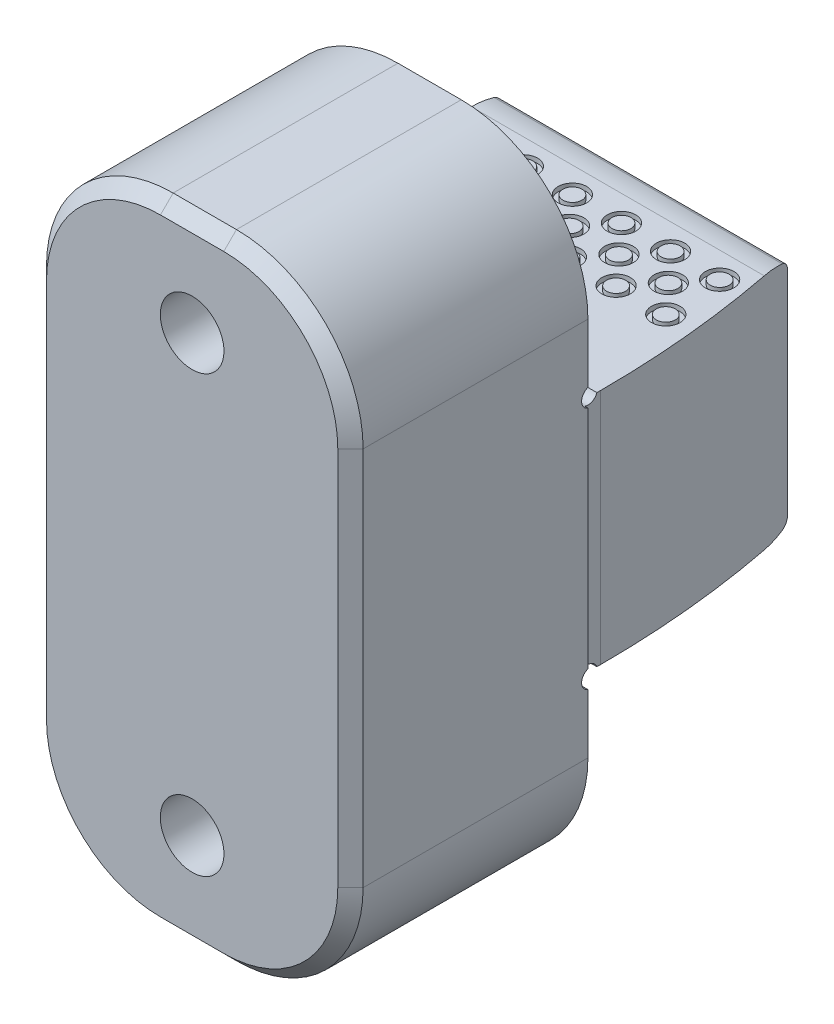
SolidWorks part; units mm, degrees
ref_plane "Front Plane" through (0, 0, 0) normal (0, 0, 1) x (1, 0, 0)
ref_plane "Top Plane" through (0, 0, 0) normal (0, 1, 0) x (1, 0, 0)
ref_plane "Right Plane" through (0, 0, 0) normal (1, 0, 0) x (0, 0, -1)
sketch "Sketch3" plane through (0, 0, 0) normal (1, 0, 0) x (0, 0, -1)
  line L0 (0, 13.97) -> (0, -13.97) construction
  line L1 (-19.05, -25.4) -> (0, -25.4)
  line L2 (-19.05, -25.4) -> (-19.05, 25.4)
  line L3 (-19.05, 25.4) -> (0, 25.4)
  line L4 (18.161, -9.5225) -> (18.161, 9.5225)
  line L6 (0, -25.4) -> (0, -9.5225)
  line L7 (0, -9.5225) -> (18.161, -9.5225)
  line L8 (0, 25.4) -> (0, 9.5225)
  line L9 (0, 9.5225) -> (18.161, 9.5225)
  line L10 (0, 0) -> (50000, 0) construction
  dimension "D1" = 37.211
  dimension "D2" = 19.05
  dimension "D3" = 50.8
  dimension "D4" = 19.0449
extrude "Extrude1" add sketch "Sketch3" along normal mid plane 25.4
sketch "Sketch7" plane through (12.7, 0, 0) normal (1, 0, 0) x (0, 0, -1)
  line L1 (0, -14.5526) -> (21.9683, -14.5526)
  line L2 (0, -14.5526) -> (0, 17.1683)
  line L3 (0, 17.1683) -> (21.9683, 17.1683)
  line L4 (21.9683, -14.5526) -> (21.9683, 17.1683)
  line L5 (0, -25.4) -> (0, -9.5225) construction
extrude "Cut-Extrude3" cut sketch "Sketch7" against normal blind 0.254
mirror "Mirror2" about plane through (0, 0, 0) normal (1, 0, 0) of "Cut-Extrude3"
sketch "Sketch8" plane through (12.7, 0, 0) normal (1, 0, 0) x (0, 0, -1)
  line L0 (0, 0) -> (50000, 0) construction
  line L1 (0, -25.4) -> (0, 25.4) construction
  line L2 (0, 9.5225) -> (18.161, 9.5225) construction
  circle A0 centre (0.254, 9.7765) radius 0.762
  circle A1 centre (0.254, -9.7765) radius 0.762
  dimension "D1" = 0.762
  dimension "D2" = 0.508
  dimension "D3" = 0.508
extrude "Cut-Extrude4" cut sketch "Sketch8" against normal through all
sketch "Sketch9" plane through (12.7, 0, 0) normal (1, 0, 0) x (0, 0, -1)
  line L0 (0.9724, 9.5225) -> (18.161, 9.5225) construction
  line L1 (18.161, 9.5225) -> (18.161, -9.5225) construction
  line L2 (0, 0) -> (50000, 0) construction
  line L3 (18.161, 8.5264) -> (22.1488, 8.5264)
  line L4 (15.7988, 9.5225) -> (15.7988, 14.8764)
  line L5 (15.7988, 14.8764) -> (22.1488, 14.8764)
  line L6 (22.1488, 8.5264) -> (22.1488, 14.8764)
  line L7 (22.1488, -8.5264) -> (22.1488, -14.8764)
  line L8 (15.7988, -14.8764) -> (22.1488, -14.8764)
  line L9 (15.7988, -9.5225) -> (15.7988, -14.8764)
  line L10 (18.161, -8.5264) -> (22.1488, -8.5264)
  arc A0 (15.7988, 9.5225) -> (17.6172, 9.2565) centre (15.7988, 3.1725) cw
  arc A1 (17.6172, 9.2565) -> (18.161, 8.5264) centre (17.399, 8.5264) cw
  arc A2 (17.6172, -9.2565) -> (18.161, -8.5264) centre (17.399, -8.5264) ccw
  arc A3 (15.7988, -9.5225) -> (17.6172, -9.2565) centre (15.7988, -3.1725) ccw
  dimension "D1" = 0.762
  dimension "D2" = 6.35
  dimension "D3" = 2.3622
  dimension "D4" = 6.35
  dimension "D5" = 6.35
extrude "Cut-Extrude5" cut sketch "Sketch9" against normal through all
sketch "Sketch13" plane through (0, 25.4, 0) normal (0, 1, 0) x (1, 0, 0)
  line L0 (12.446, 0.9724) -> (12.446, 15.7988) construction
  line L2 (8.088, 26.67) -> (20.788, 26.67)
  line L4 (12.446, 1.27) -> (20.788, 1.27)
  line L5 (20.788, 26.67) -> (20.788, 1.27)
  arc A0 (8.088, 26.67) -> (12.446, 1.27) centre (-63.754, 1.27) cw
  dimension "D1" = 76.2
  dimension "D2" = 1.27
  dimension "D3" = 25.4
  dimension "D4" = 12.7
extrude "Cut-Extrude6" cut sketch "Sketch13" against normal through all
sketch "Sketch15" plane through (0, 9.5225, 0) normal (0, 1, 0) x (1, 0, 0)
  line L0 (12.7, -19.05) -> (-12.7, -19.05) construction
  line L1 (-12.7, 15.7988) -> (-12.7, -0.4644) construction
  line L2 (-12.7, 0) -> (-12.7, -19.05) construction
  circle A0 centre (-6.223, 13.7414) radius 1.143
  circle A1 centre (-6.223, 13.7414) radius 0.762
  circle A2 centre (-2.286, 13.7414) radius 1.143
  circle A3 centre (-2.286, 13.7414) radius 0.762
  circle A4 centre (-10.16, 13.7414) radius 1.143
  circle A5 centre (-10.16, 13.7414) radius 0.762
  circle A6 centre (1.651, 13.7414) radius 1.143
  circle A7 centre (1.651, 13.7414) radius 0.762
  circle A8 centre (5.588, 13.7414) radius 1.143
  circle A9 centre (5.588, 13.7414) radius 0.762
  circle A10 centre (9.525, 13.7414) radius 1.143
  circle A11 centre (9.525, 13.7414) radius 0.762
  circle A12 centre (-4.191, 11.4554) radius 1.143
  circle A13 centre (-4.191, 11.4554) radius 0.762
  circle A14 centre (-0.2286, 11.4554) radius 1.143
  circle A15 centre (-0.2286, 11.4554) radius 0.762
  circle A16 centre (-8.1534, 11.4554) radius 1.143
  circle A17 centre (-8.1534, 11.4554) radius 0.762
  circle A18 centre (3.7338, 11.4554) radius 1.143
  circle A19 centre (3.7338, 11.4554) radius 0.762
  circle A20 centre (7.6962, 11.4554) radius 1.143
  circle A21 centre (7.6962, 11.4554) radius 0.762
  circle A24 centre (-6.1722, 9.1694) radius 1.143
  circle A25 centre (-6.1722, 9.1694) radius 0.762
  circle A26 centre (-2.1844, 9.1694) radius 1.143
  circle A27 centre (-2.1844, 9.1694) radius 0.762
  circle A28 centre (-10.16, 9.1694) radius 1.143
  circle A29 centre (-10.16, 9.1694) radius 0.762
  circle A30 centre (1.8034, 9.1694) radius 1.143
  circle A31 centre (1.8034, 9.1694) radius 0.762
  circle A32 centre (5.7912, 9.1694) radius 1.143
  circle A33 centre (5.7912, 9.1694) radius 0.762
  circle A34 centre (9.779, 9.1694) radius 1.143
  circle A35 centre (9.779, 9.1694) radius 0.762
  dimension "D1" = 32.7914
  dimension "D2" = 2.286
  dimension "D12" = 3.9878
  dimension "D7" = 2.286
  dimension "D8" = 1.524
  dimension "D3" = 2.286
  dimension "D4" = 2.54
  dimension "D5" = 4.5466
  dimension "D6" = 3.9878
  dimension "D9" = 3.9878
  dimension "D10" = 3.9878
  dimension "D11" = 3.9878
  dimension "D13" = 3.937
  dimension "D14" = 3.937
  dimension "D15" = 3.937
  dimension "D16" = 3.937
  dimension "D17" = 3.937
  dimension "D18" = 3.9624
  dimension "D19" = 3.9624
  dimension "D20" = 3.9624
  dimension "D21" = 3.9624
extrude "Cut-Extrude7" cut sketch "Sketch15" against normal blind 0.381
mirror "Mirror1" about plane through (0, 0, 0) normal (0, 1, 0) of "Cut-Extrude7"
hole_wizard "#10 CBORE" positions "Sketch11" profile "Sketch10" counterbore size "#10" standard "Ansi Inch"
sketch "Sketch11" plane through (0, 0, 0) normal (0, 0, -1) x (-1, 0, 0)
  line L0 (0, 0) -> (0, 50000) construction
  line L1 (0, 0) -> (50000, 0) construction
  point P0 (0, 17.4625)
  point P10 (0, -17.4625)
  dimension "D1" = 34.925
sketch "Sketch10" plane through (0, 17.4625, 0) normal (1, 0, 0) x (0, 1, 0)
  line L0 (0, 0) -> (0, 19.05)
  line L1 (0, 19.05) -> (2.286, 19.05)
  line L3 (2.286, 19.05) -> (2.286, 5.621)
  line L4 (2.286, 5.621) -> (4.7625, 5.621)
  line L5 (4.7625, 5.621) -> (4.7625, 0)
  line L7 (4.7625, 0) -> (0, 0)
  line L11 (0, -6.35) -> (0, 107.95) construction
  dimension "Thru Hole Dia." = 4.572
  dimension "Thru Hole Depth" = 19.05
  dimension "C'Bore Dia." = 9.525
  dimension "C'Bore Depth" = 5.621
hole_wizard "1/4-20 Tapped Hole1" positions "Sketch17" profile "Sketch16" tap size "1/4-20" standard "Ansi Inch"
sketch "Sketch17" plane through (0, 0, 5.621) normal (0, 0, -1) x (-1, 0, 0)
  point P0 (0, 17.4625)
  point P1 (0, -17.4625)
sketch "Sketch16" plane through (0, 17.4625, 5.621) normal (1, 0, 0) x (0, 1, 0)
  line L0 (0, 0) -> (0, 13.429)
  line L1 (0, 13.429) -> (2.5527, 13.429)
  line L2 (2.5527, 13.429) -> (2.5527, 0)
  line L5 (2.5527, 0) -> (0, 0)
  line L11 (0, -6.35) -> (0, 107.95) construction
  dimension "Thread Major Dia." = 5.1054
  dimension "Thru Tap Drill Depth" = 13.429
fillet "Fillet1" radius 10.16 4 edges at (-12.7, 25.4, 9.525) (-12.7, -25.4, 9.525) (12.7, -25.4, 9.525) (12.7, 25.4, 9.525)
chamfer "Chamfer1" distance 1.016 angle 45 8 edges at (0, 25.4, 19.05) (-9.7242, 22.4242, 19.05) (-12.7, 0, 19.05) (0, -25.4, 19.05) (-9.7242, -22.4242, 19.05) (12.7, 0, 19.05) (9.7242, 22.4242, 19.05) (9.7242, -22.4242, 19.05)
